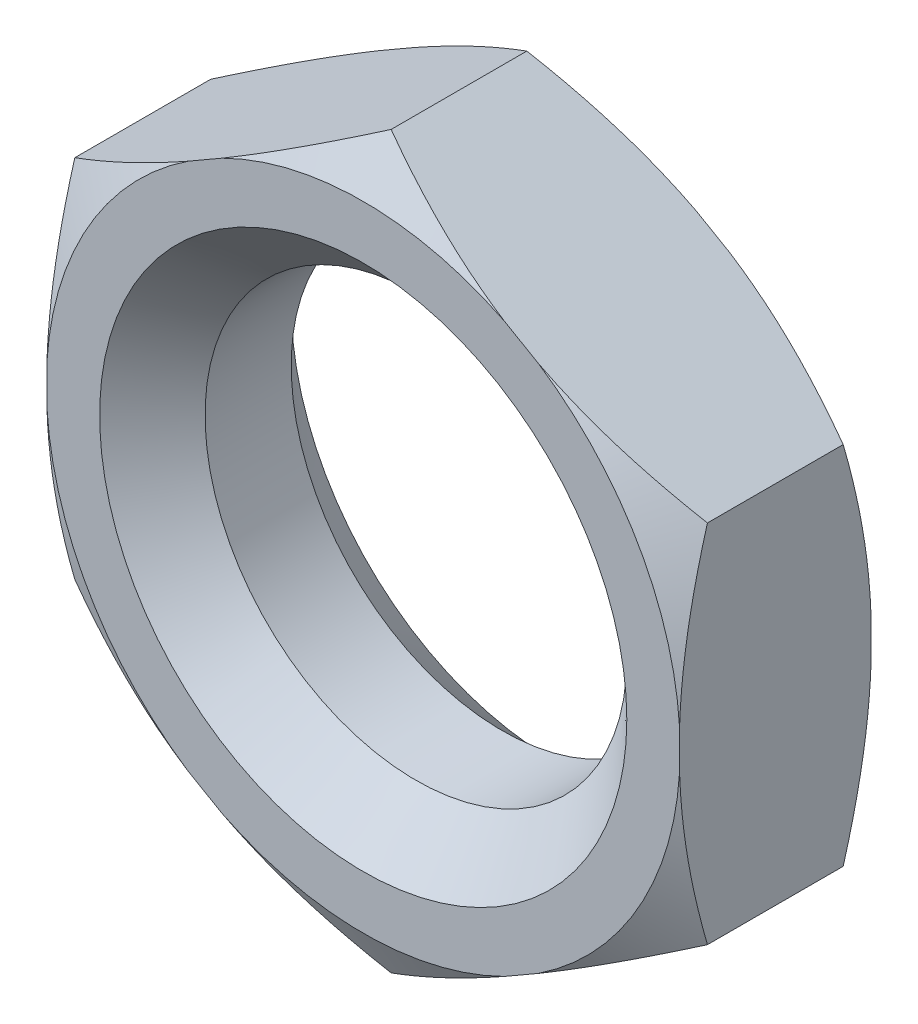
SolidWorks part; units mm, degrees
ref_plane "Front Plane" through (0, 0, 0) normal (0, 0, 1) x (1, 0, 0)
ref_plane "Top Plane" through (0, 0, 0) normal (0, 1, 0) x (1, 0, 0)
ref_plane "Right Plane" through (0, 0, 0) normal (1, 0, 0) x (0, 0, -1)
sketch "Sketch3" plane through (0, 0, 0) normal (0, 0, 1) x (1, 0, 0)
  line L1 (0, 20.7846) -> (-18, 10.3923)
  line L2 (-18, 10.3923) -> (-18, -10.3923)
  line L3 (-18, -10.3923) -> (0, -20.7846)
  line L4 (0, -20.7846) -> (18, -10.3923)
  line L5 (18, -10.3923) -> (18, 10.3923)
  line L6 (18, 10.3923) -> (0, 20.7846)
  circle A0 centre (0, 0) radius 18 construction
  dimension "D1" = 36
extrude "Boss-Extrude1" add sketch "Sketch3" along normal mid plane 10.9
sketch "Sketch4" plane through (0, 0, 0) normal (1, 0, 0) x (0, 0, -1)
  line L0 (-5.4578, 0) -> (6.1545, 0) construction
sketch "Sketch5" plane through (0, 0, 0) normal (1, 0, 0) x (0, 0, -1)
  line L0 (-5.45, 20.7846) -> (-5.45, 18.0346)
  line L1 (-5.45, 10.3923) -> (-5.45, 20.7846) construction
  line L2 (-5.45, 18.0346) -> (-3.8623, 20.7846)
  line L3 (-5.45, 20.7846) -> (5.45, 20.7846) construction
  line L4 (-3.8623, 20.7846) -> (-5.45, 20.7846)
  dimension "D1" = 2.75
  dimension "D2" = 30
revolve "Cut-Revolve1" cut sketch "Sketch5" angle 360 about L0
mirror "Mirror1" about plane through (0, 0, 0) normal (0, 0, 1) of "Cut-Revolve1"
sketch "Sketch6" plane through (0, 0, 5.45) normal (0, 0, 1) x (1, 0, 0)
  circle A0 centre (0, 0) radius 12
  dimension "D1" = 24
extrude "Cut-Extrude1" cut sketch "Sketch6" against normal blind 10.9
chamfer "Chamfer1" distance 3 angle 45 2 edges at (12, 0, -5.45) (12, 0, 5.45)
